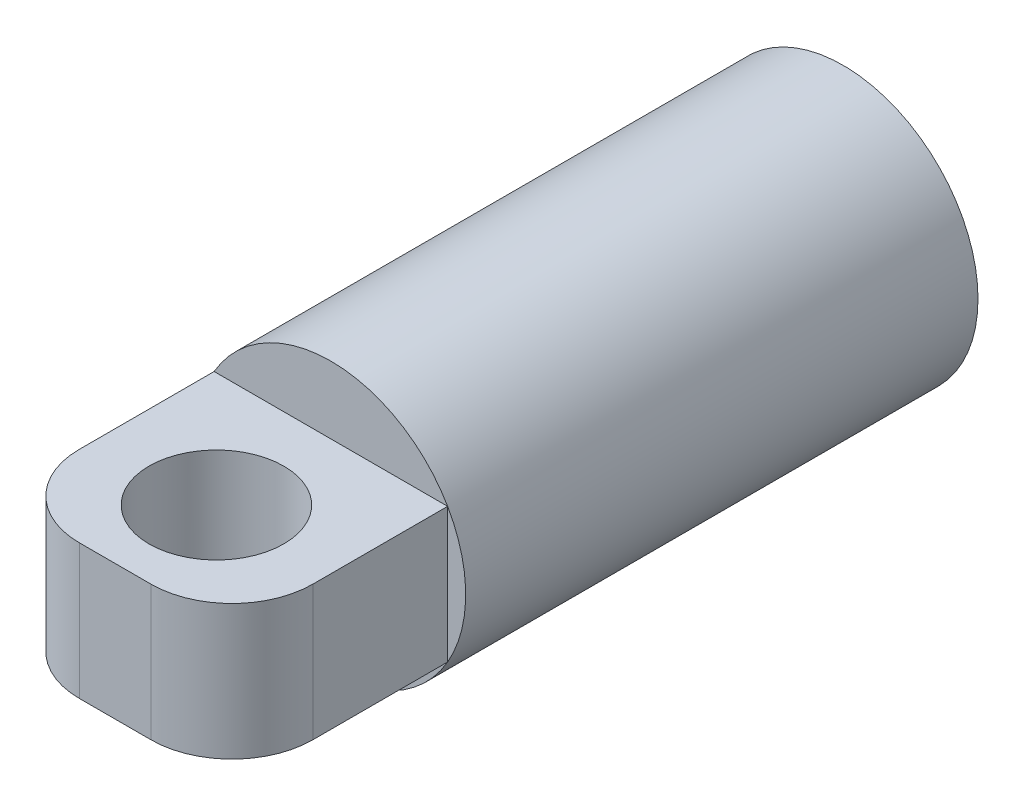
SolidWorks part; units mm, degrees
ref_plane "Front Plane" through (0, 0, 0) normal (0, 0, 1) x (1, 0, 0)
ref_plane "Top Plane" through (0, 0, 0) normal (0, 1, 0) x (1, 0, 0)
ref_plane "Right Plane" through (0, 0, 0) normal (1, 0, 0) x (0, 0, -1)
sketch "Sketch1" plane through (0, 0, 0) normal (0, 0, 1) x (1, 0, 0)
  circle A0 centre (0, 0) radius 5
  dimension "D1" = 10
extrude "Boss-Extrude1" add sketch "Sketch1" along normal blind 27
sketch "Sketch2" plane through (0, 0, 27) normal (0, 0, 1) x (1, 0, 0)
  line L1 (-4.3301, -2.5) -> (4.3301, -2.5)
  line L2 (-4.3301, -2.5) -> (-4.3301, 2.5)
  line L3 (-4.3301, 2.5) -> (4.3301, 2.5)
  line L4 (4.3301, -2.5) -> (4.3301, 2.5)
  line L5 (-4.3301, -2.5) -> (4.3301, 2.5) construction
  line L6 (-4.3301, 2.5) -> (4.3301, -2.5) construction
  circle A4 centre (0, 0) radius 5 construction
  point P0 (0, 0)
  dimension "D1" = 5
extrude "Cut-Extrude1" cut sketch "Sketch2" against normal blind 8 flip side to cut
fillet "Fillet2" radius 3 2 edges at (4.3301, 0, 27) (-4.3301, 0, 27)
sketch "Sketch4" plane through (0, -2.5, 0) normal (0, -1, 0) x (1, 0, 0)
  circle A0 centre (0, 23.2451) radius 2.5
  dimension "D1" = 5
extrude "Cut-Extrude2" cut sketch "Sketch4" against normal blind 8
